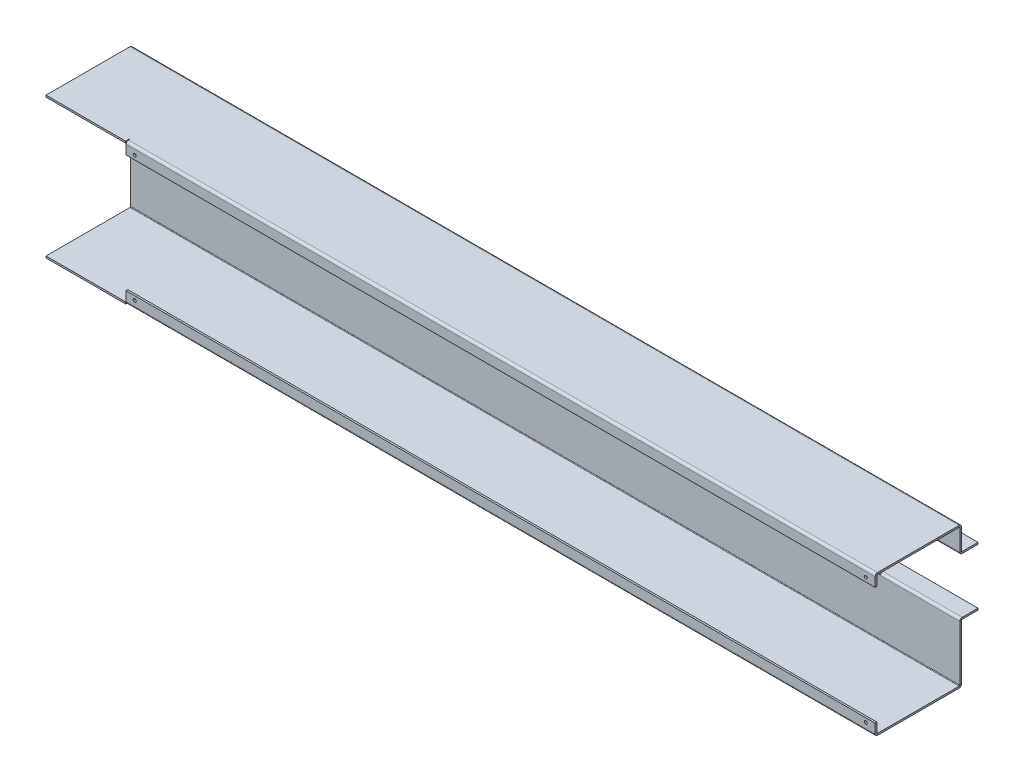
SolidWorks part; units mm, degrees
ref_plane "Ebene vorne" through (0, 0, 0) normal (0, 0, 1) x (1, 0, 0)
ref_plane "Ebene oben" through (0, 0, 0) normal (0, 1, 0) x (1, 0, 0)
ref_plane "Ebene rechts" through (0, 0, 0) normal (1, 0, 0) x (0, 0, -1)
imported_body "Oberfläche-Importiert6"
surface "Oberfläche-Offset1" parameters "D1"=0
delete or keep bodies "Körper-Löschen1" type delete bodies bodies 106
sheet metal parameters "Blech1" thickness 2.9999 parameters "D1"=1
convert to sheet metal "Volumenkörper übernehmen1" parameters "D1"=1
bend "Biegung-Rundung1" bend radius 1 bend angle 90 parameters "D5"=1
bend "Biegung-Rundung2" bend radius 1 bend angle 90 parameters "D5"=2
bend "Biegung-Rundung3" bend radius 1 bend angle 90 parameters "D5"=3
bend "Biegung-Rundung4" bend radius 1.0001 bend angle 90 parameters "D5"=4
bend "Biegung-Rundung5" bend radius 1.0001 bend angle 90 parameters "D5"=5
bend "Biegung-Rundung6" bend radius 1.0001 bend angle 90 parameters "D5"=6
bend "Biegung-Rundung7" bend radius 1.0001 bend angle 90 parameters "D5"=7
bend "Biegung-Rundung8" bend radius 1 bend angle 90 parameters "D5"=8
bend "Biegung-Rundung9" bend radius 1 bend angle 90 parameters "D5"=9
bend "Biegung-Rundung10" bend radius 1 bend angle 90 parameters "D5"=10
flat pattern "Abwicklung1"
sketch "Biegung-Linien1" plane through (0, 0, -4) normal (0, 0, -1) x (-1, 0, 0)
  line L0 (482, 195.0365) -> (347.275, 195.0365) construction
  line L1 (344.9635, 192.725) -> (344.9635, 99.275) construction
  line L2 (347.275, 96.9635) -> (482, 96.9635) construction
  line L3 (-929, 377.8906) -> (345.575, 377.8906) construction
  line L4 (-929, 234.9635) -> (482, 234.9635) construction
  line L5 (345.575, -143.8906) -> (-929, -143.8906) construction
  line L6 (482, -0.9635) -> (-929, -0.9635) construction
  line L7 (-929, 96.9635) -> (-794.275, 96.9635) construction
  line L8 (-791.9635, 99.275) -> (-791.9635, 192.725) construction
  line L9 (-794.275, 195.0365) -> (-929, 195.0365) construction
  line L10 (482, 195.0365) -> (347.275, 195.0365) construction
  line L11 (344.9635, 192.725) -> (344.9635, 99.275) construction
  line L12 (347.275, 96.9635) -> (482, 96.9635) construction
  line L13 (-929, 377.8906) -> (345.575, 377.8906) construction
  line L14 (-929, 234.9635) -> (482, 234.9635) construction
  line L15 (345.575, -143.8906) -> (-929, -143.8906) construction
  line L16 (482, -0.9635) -> (-929, -0.9635) construction
  line L17 (-929, 96.9635) -> (-794.275, 96.9635) construction
  line L18 (-791.9635, 99.275) -> (-791.9635, 192.725) construction
  line L19 (-794.275, 195.0365) -> (-929, 195.0365) construction
sketch3d "Rahmen1" [suppressed]
  line L0 (705.5, -278.8541, 0) -> (-705.5, -278.8541, 0) construction
  line L1 (705.5, 278.8541, 0) -> (-705.5, 278.8541, 0) construction
  line L2 (705.5, -278.8541, 0) -> (705.5, 278.8541, 0) construction
  line L3 (-705.5, -278.8541, 0) -> (-705.5, 278.8541, 0) construction
bend of the flat pattern "Abwickeln-<Biegung-Rundung1>1"
bend of the flat pattern "Abwickeln-<Biegung-Rundung2>1"
bend of the flat pattern "Abwickeln-<Biegung-Rundung3>1"
bend of the flat pattern "Abwickeln-<Biegung-Rundung4>1"
bend of the flat pattern "Abwickeln-<Biegung-Rundung5>1"
bend of the flat pattern "Abwickeln-<Biegung-Rundung6>1"
bend of the flat pattern "Abwickeln-<Biegung-Rundung7>1"
bend of the flat pattern "Abwickeln-<Biegung-Rundung8>1"
bend of the flat pattern "Abwickeln-<Biegung-Rundung9>1"
bend of the flat pattern "Abwickeln-<Biegung-Rundung10>1"
